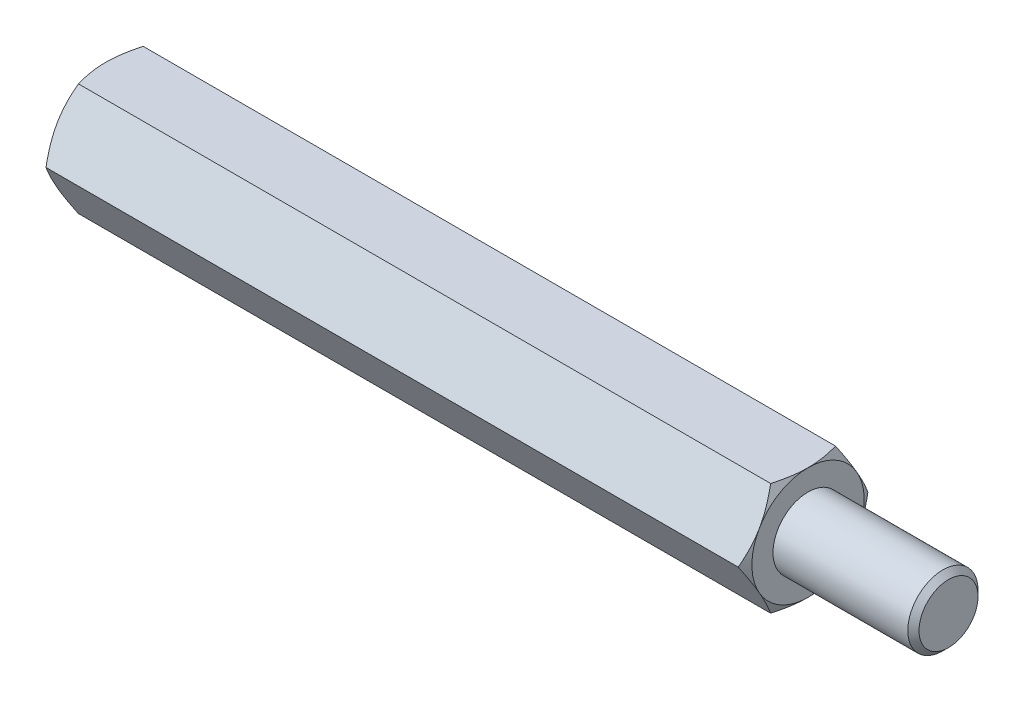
SolidWorks part; units mm, degrees
ref_plane "Front Plane" through (0, 0, 0) normal (0, 0, 1) x (1, 0, 0)
ref_plane "Top Plane" through (0, 0, 0) normal (0, 1, 0) x (1, 0, 0)
ref_plane "Right Plane" through (0, 0, 0) normal (1, 0, 0) x (0, 0, -1)
sketch "Sketch1" plane through (0, 0, 0) normal (1, 0, 0) x (0, 0, -1)
  line L1 (2.3094, 4) -> (-2.3094, 4)
  line L2 (-2.3094, 4) -> (-4.6188, 0)
  line L3 (-4.6188, 0) -> (-2.3094, -4)
  line L4 (-2.3094, -4) -> (2.3094, -4)
  line L5 (2.3094, -4) -> (4.6188, 0)
  line L6 (4.6188, 0) -> (2.3094, 4)
  circle A0 centre (0, 0) radius 4 construction
  dimension "D1" = 8
extrude "Extrude2" add sketch "Sketch1" along normal mid plane 50
sketch "Sketch2" plane through (0, 0, 0) normal (0, 0, 1) x (1, 0, 0)
  line L0 (-25, 4) -> (-23.5, 6.5981)
  line L1 (-25, 7) -> (-25, 4)
  line L3 (0, 0) -> (50000, 0) construction
  arc A0 (-23.5, 6.5981) -> (-25, 7) centre (-24.1962, 7) ccw
  dimension "D1" = 30
  dimension "D2" = 3
revolve "Cut-Revolve1" cut sketch "Sketch2" angle 360 about L3
mirror "Mirror1" about plane through (0, 0, 0) normal (1, 0, 0) of "Cut-Revolve1"
sketch "Sketch3" plane through (-25, 0, 0) normal (-1, 0, 0) x (0, 0, 1)
  circle A0 centre (0, 0) radius 2.1
  dimension "D1" = 4.2
extrude "Extrude3" cut sketch "Sketch3" against normal blind 10
sketch "Sketch4" plane through (0, 0, 0) normal (0, 0, 1) x (1, 0, 0)
  line L0 (-15, 0) -> (-15, 2.1)
  line L1 (24.6427, 0) -> (-24.6427, 0) construction
  line L2 (-15, 2.1) -> (-13.7876, 0)
  line L3 (-13.7876, 0) -> (-15, 0)
  line L4 (-25, 2) -> (-25, -2) construction
  point P4 (-25, 0)
  dimension "D1" = 30
  dimension "D2" = 2.1
  dimension "D3" = 10
revolve "Cut-Revolve2" cut sketch "Sketch4" angle 360 about L3
sketch "Sketch5" plane through (25, 0, 0) normal (1, 0, 0) x (0, 0, -1)
  circle A0 centre (0, 0) radius 2.5
  dimension "D1" = 5
extrude "Extrude4" add sketch "Sketch5" along normal blind 10
chamfer "Chamfer1" distance 0.4 angle 45 1 edges at (35, 0, -2.5)
equation "\"D2@Sketch4\" = \"D1@Sketch3\"/2"
